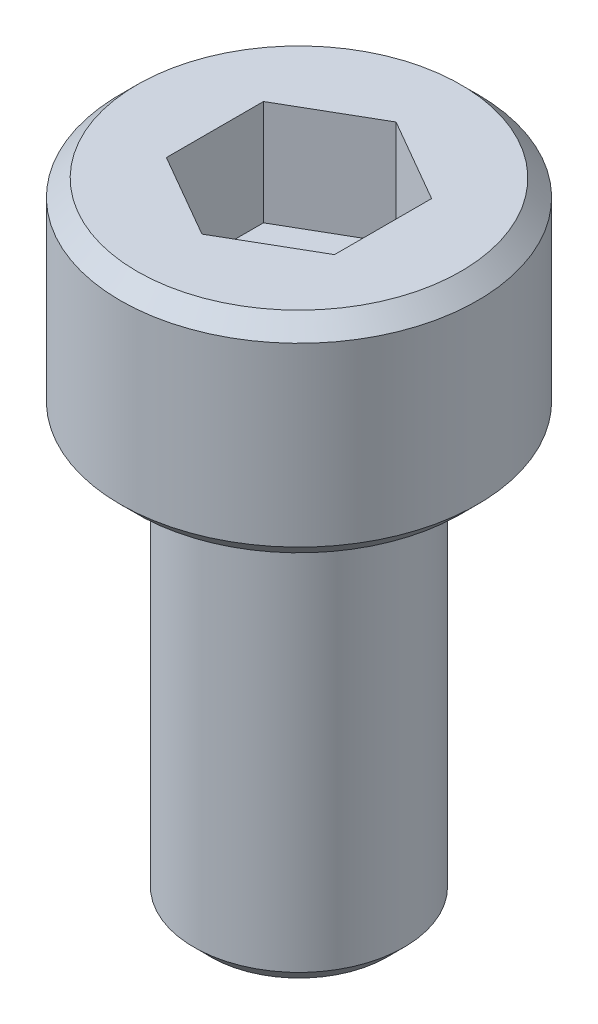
SolidWorks part; units mm, degrees
ref_plane "Face" through (0, 0, 0) normal (0, 0, 1) x (1, 0, 0)
ref_plane "Dessus" through (0, 0, 0) normal (0, 1, 0) x (1, 0, 0)
ref_plane "Droite" through (0, 0, 0) normal (1, 0, 0) x (0, 0, -1)
sketch "Esquisse1" plane through (0, 0, 0) normal (0, 0, 1) x (1, 0, 0)
  line L0 (0, 0) -> (0, 32.1848) construction
  line L1 (0, 0) -> (2.5, 0)
  line L2 (2.5, 0) -> (2.5, 10)
  line L3 (2.5, 10) -> (4.25, 10)
  line L4 (4.25, 10) -> (4.25, 15)
  line L5 (4.25, 15) -> (0, 15)
  line L6 (0, 0) -> (0, 15)
  dimension "D1" = 5
  dimension "D2" = 10
  dimension "D3" = 8.5
  dimension "D4" = 5
revolve "Révolution1" add sketch "Esquisse1" angle 360 about L0
chamfer "Chanfrein1" distance 0.4 angle 45 3 edges at (0, 0, -2.5) (0, 15, -4.25) (0, 10, -4.25)
sketch "Esquisse2" plane through (0, 15, 0) normal (0, 1, 0) x (-1, 0, 0)
  line L1 (-2, 1.1547) -> (-2, -1.1547)
  line L2 (-2, -1.1547) -> (0, -2.3094)
  line L3 (0, -2.3094) -> (2, -1.1547)
  line L4 (2, -1.1547) -> (2, 1.1547)
  line L5 (2, 1.1547) -> (0, 2.3094)
  line L6 (0, 2.3094) -> (-2, 1.1547)
  circle A0 centre (0, 0) radius 2 construction
  dimension "D1" = 4
extrude "Enlèv. mat.-Extru.1" cut sketch "Esquisse2" against normal blind 2.5
